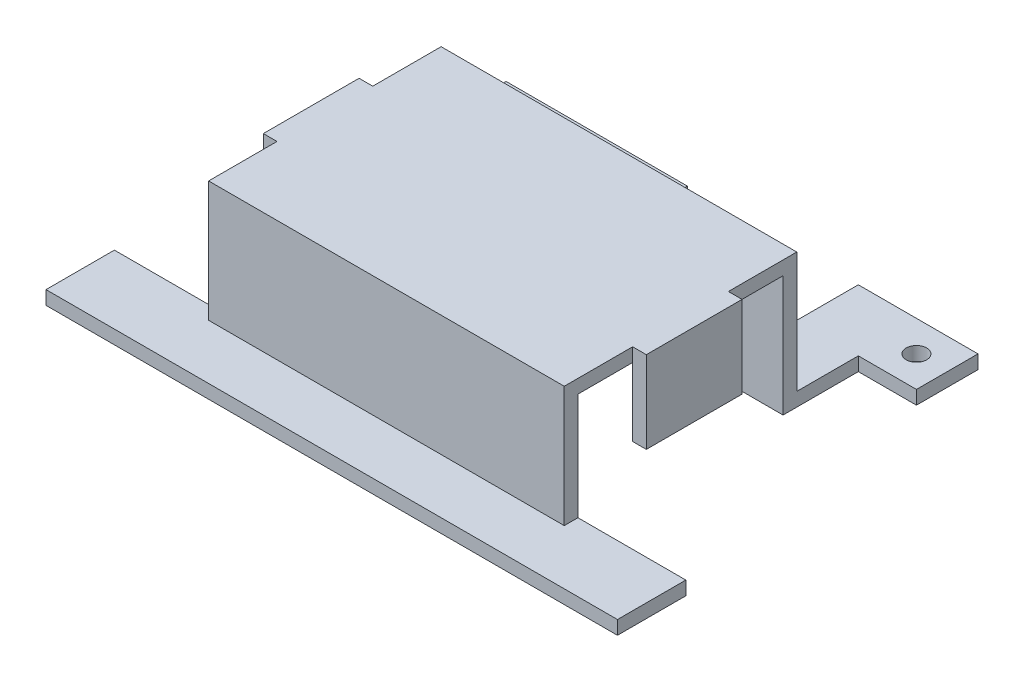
SolidWorks part; units mm, degrees
ref_plane "Front Plane" through (0, 0, 0) normal (0, 0, 1) x (1, 0, 0)
ref_plane "Top Plane" through (0, 0, 0) normal (0, 1, 0) x (1, 0, 0)
ref_plane "Right Plane" through (0, 0, 0) normal (1, 0, 0) x (0, 0, -1)
sketch "Sketch1" plane through (0, 0, 0) normal (0, 1, 0) x (1, 0, 0)
  line L1 (0, 0) -> (52, 0)
  line L2 (0, 0) -> (0, 34)
  line L3 (0, 34) -> (52, 34)
  line L4 (52, 0) -> (52, 34)
  dimension "D1" = 52
  dimension "D2" = 34
extrude "Boss-Extrude1" add sketch "Sketch1" along normal blind 19.65
sketch "Sketch2" plane through (0, 0, 0) normal (0, -1, 0) x (-1, 0, 0)
  line L0 (-52, 0) -> (-52, 34) construction
  line L1 (-52, 2) -> (0, 2)
  line L2 (-52, 2) -> (-52, 32)
  line L3 (-52, 32) -> (0, 32)
  line L4 (0, 2) -> (0, 32)
  line L5 (0, 34) -> (0, 0) construction
  line L6 (0, 0) -> (-52, 0) construction
  line L7 (-52, 34) -> (0, 34) construction
  dimension "D1" = 2
  dimension "D2" = 2
extrude "Cut-Extrude1" cut sketch "Sketch2" against normal blind 17.65
sketch "Sketch3" plane through (0, 0, -34) normal (0, 0, -1) x (-1, 0, 0)
  line L1 (-52, 0) -> (-43, 0)
  line L2 (-52, 0) -> (-52, 2)
  line L3 (-52, 2) -> (-43, 2)
  line L4 (-43, 0) -> (-43, 2)
  line L5 (0, 0) -> (-18, 0)
  line L6 (0, 0) -> (0, 2)
  line L7 (0, 2) -> (-18, 2)
  line L8 (-18, 0) -> (-18, 2)
  dimension "D1" = 9
  dimension "D2" = 2
  dimension "D3" = 18
  dimension "D4" = 2
extrude "Boss-Extrude2" add sketch "Sketch3" along normal blind 18
sketch "Sketch4" plane through (52, 0, 0) normal (1, 0, 0) x (0, 0, -1)
  line L0 (52, 2) -> (52, 0) construction
  line L1 (34, 2) -> (52, 2)
  line L2 (34, 2) -> (34, 0)
  line L3 (34, 0) -> (52, 0)
  line L4 (52, 2) -> (52, 0)
  line L5 (32, 0) -> (52, 0) construction
extrude "Boss-Extrude3" add sketch "Sketch4" along normal blind 8.5
sketch "Sketch5" plane through (0, 0, 0) normal (-1, 0, 0) x (0, 0, 1)
  line L1 (-34, 2) -> (-52, 2)
  line L2 (-34, 2) -> (-34, 0)
  line L3 (-34, 0) -> (-52, 0)
  line L4 (-52, 2) -> (-52, 0)
extrude "Boss-Extrude4" add sketch "Sketch5" along normal blind 8.5
sketch "Sketch6" plane through (0, 2, 0) normal (0, 1, 0) x (1, 0, 0)
  line L0 (-8.5, 34) -> (-8.5, 52) construction
  line L1 (-8.5, 52) -> (18, 52) construction
  line L2 (43, 52) -> (60.5, 52) construction
  line L3 (60.5, 52) -> (60.5, 34) construction
  circle A0 centre (56, 47.5) radius 1.5
  circle A1 centre (-4, 47.5) radius 1.5
  dimension "D1" = 3
  dimension "D2" = 3
  dimension "D3" = 4.5
  dimension "D4" = 4.5
  dimension "D5" = 4.5
  dimension "D6" = 4.5
extrude "Cut-Extrude2" cut sketch "Sketch6" against normal through all
sketch "Sketch7" plane through (0, 0, 0) normal (0, 0, 1) x (1, 0, 0)
  line L0 (0, 19.65) -> (0, 0) construction
  line L1 (0, 2) -> (52, 2)
  line L2 (0, 2) -> (0, 0)
  line L3 (0, 0) -> (52, 0)
  line L4 (52, 2) -> (52, 0)
  dimension "D1" = 2
extrude "Boss-Extrude5" add sketch "Sketch7" along normal blind 8
sketch "Sketch8" plane through (0, 0, 0) normal (-1, 0, 0) x (0, 0, 1)
  line L0 (-2, 0) -> (8, 0) construction
  line L1 (8, 2) -> (-2, 2)
  line L2 (8, 2) -> (8, 0)
  line L3 (8, 0) -> (-2, 0)
  line L4 (-2, 2) -> (-2, 0)
extrude "Boss-Extrude6" add sketch "Sketch8" along normal blind 15.78
sketch "Sketch9" plane through (52, 0, 0) normal (1, 0, 0) x (0, 0, -1)
  line L1 (-8, 2) -> (2, 2)
  line L2 (-8, 2) -> (-8, 0)
  line L3 (-8, 0) -> (2, 0)
  line L4 (2, 2) -> (2, 0)
extrude "Boss-Extrude7" add sketch "Sketch9" along normal blind 15.78
sketch "Sketch11" plane through (-8.5, 0, 0) normal (-1, 0, 0) x (0, 0, 1)
  line L1 (-43, 17.65) -> (-32, 17.65)
  line L2 (-43, 17.65) -> (-43, 0)
  line L3 (-43, 0) -> (-32, 0)
  line L4 (-32, 17.65) -> (-32, 0)
  dimension "D1" = 11
  dimension "D2" = 17.65
  dimension "D3" = 9
extrude "Cut-Extrude3" cut sketch "Sketch11" against normal blind 18
sketch "Sketch12" plane through (60.5, 0, 0) normal (1, 0, 0) x (0, 0, -1)
  line L0 (52, 2) -> (34, 2) construction
  line L1 (43, 2) -> (34, 2)
  line L2 (43, 2) -> (43, 0)
  line L3 (43, 0) -> (34, 0)
  line L4 (34, 2) -> (34, 0)
extrude "Cut-Extrude4" cut sketch "Sketch12" against normal blind 8.5
sketch "Sketch14" plane through (0, 0, 0) normal (-1, 0, 0) x (0, 0, 1)
  line L0 (-34, 19.65) -> (0, 19.65) construction
  line L1 (-24, 19.65) -> (-10, 19.65)
  line L2 (-24, 19.65) -> (-24, 17.65)
  line L3 (-24, 17.65) -> (-10, 17.65)
  line L4 (-10, 19.65) -> (-10, 17.65)
  line L5 (-2, 17.65) -> (-34, 17.65) construction
  line L7 (0, 19.65) -> (0, 2) construction
  line L8 (-34, 19.65) -> (-34, 17.65) construction
  point P10 (-10, 18.65)
  point P13 (-34, 18.65)
  dimension "D1" = 10
  dimension "D2" = 10
extrude "Boss-Extrude8" add sketch "Sketch14" along normal blind 2
sketch "Sketch15" plane through (52, 0, 0) normal (1, 0, 0) x (0, 0, -1)
  line L0 (32, 17.65) -> (2, 17.65) construction
  line L1 (24, 17.65) -> (10, 17.65)
  line L2 (24, 17.65) -> (24, 19.65)
  line L3 (24, 19.65) -> (10, 19.65)
  line L4 (10, 17.65) -> (10, 19.65)
  line L5 (0, 19.65) -> (34, 19.65) construction
  line L6 (34, 19.65) -> (34, 2) construction
  dimension "D1" = 10
  dimension "D2" = 10
extrude "Boss-Extrude9" add sketch "Sketch15" along normal blind 2
sketch "Sketch16" plane through (0, 17.65, 0) normal (0, -1, 0) x (-1, 0, 0)
  line L1 (0, 24) -> (2, 24)
  line L2 (0, 24) -> (0, 10)
  line L3 (0, 10) -> (2, 10)
  line L4 (2, 24) -> (2, 10)
  line L5 (-52, 24) -> (-54, 24)
  line L6 (-52, 24) -> (-52, 10)
  line L7 (-52, 10) -> (-54, 10)
  line L8 (-54, 24) -> (-54, 10)
extrude "Boss-Extrude10" add sketch "Sketch16" along normal blind 10
